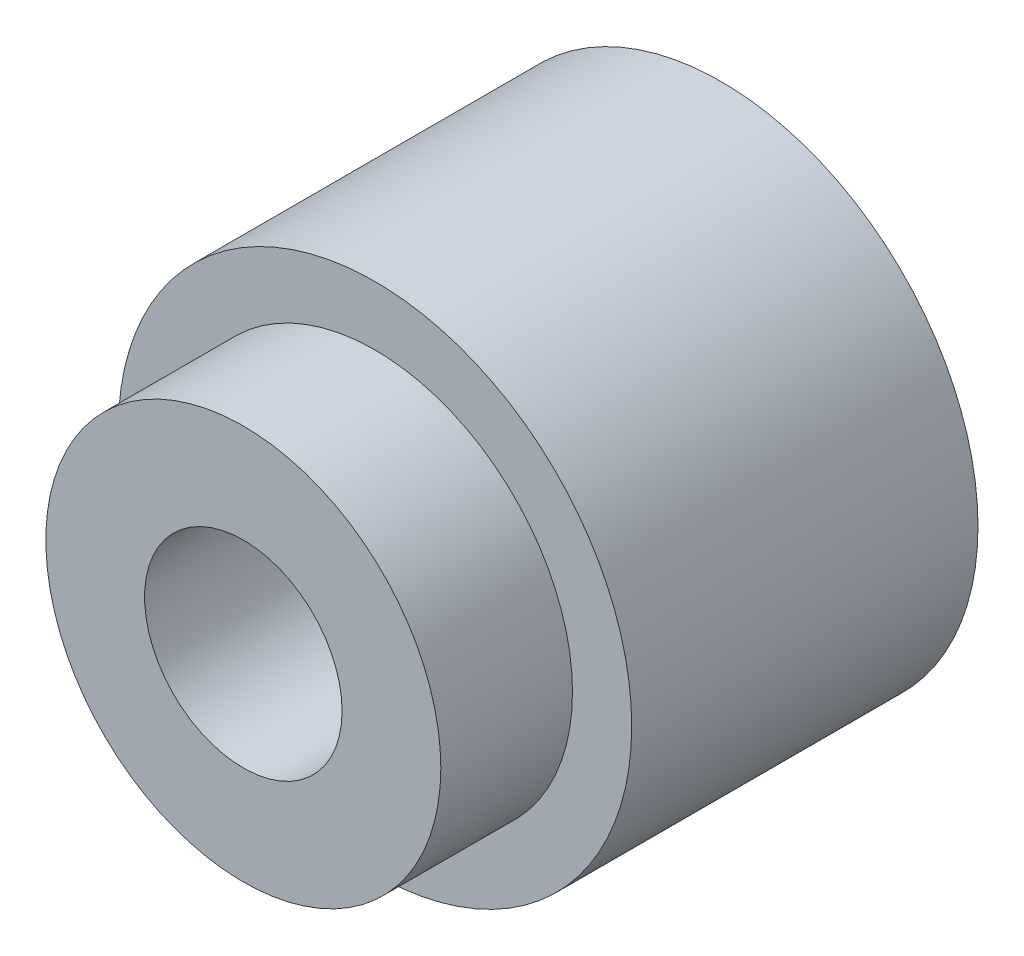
SolidWorks part; units mm, degrees
ref_plane "Face" through (0, 0, 0) normal (0, 0, 1) x (1, 0, 0)
ref_plane "Dessus" through (0, 0, 0) normal (0, 1, 0) x (1, 0, 0)
ref_plane "Droite" through (0, 0, 0) normal (1, 0, 0) x (0, 0, -1)
sketch "Esquisse1" plane through (0, 0, 0) normal (0, 0, 1) x (1, 0, 0)
  circle A0 centre (0, 0) radius 3.9
  dimension "D1" = 7.8
extrude "Base-Extrusion" add sketch "Esquisse1" against normal blind 5.26
sketch "Esquisse2" plane through (0, 0, 0) normal (0, 0, 1) x (1, 0, 0)
  circle A0 centre (0, 0) radius 3
  dimension "D1" = 6
extrude "Boss.-Extru.1" add sketch "Esquisse2" along normal blind 2
sketch "Esquisse3" plane through (0, 0, 2) normal (0, 0, 1) x (1, 0, 0)
  circle A0 centre (0, 0) radius 1.5
  dimension "D1" = 3
extrude "Enlèv. mat.-Extru.1" cut sketch "Esquisse3" against normal through all
